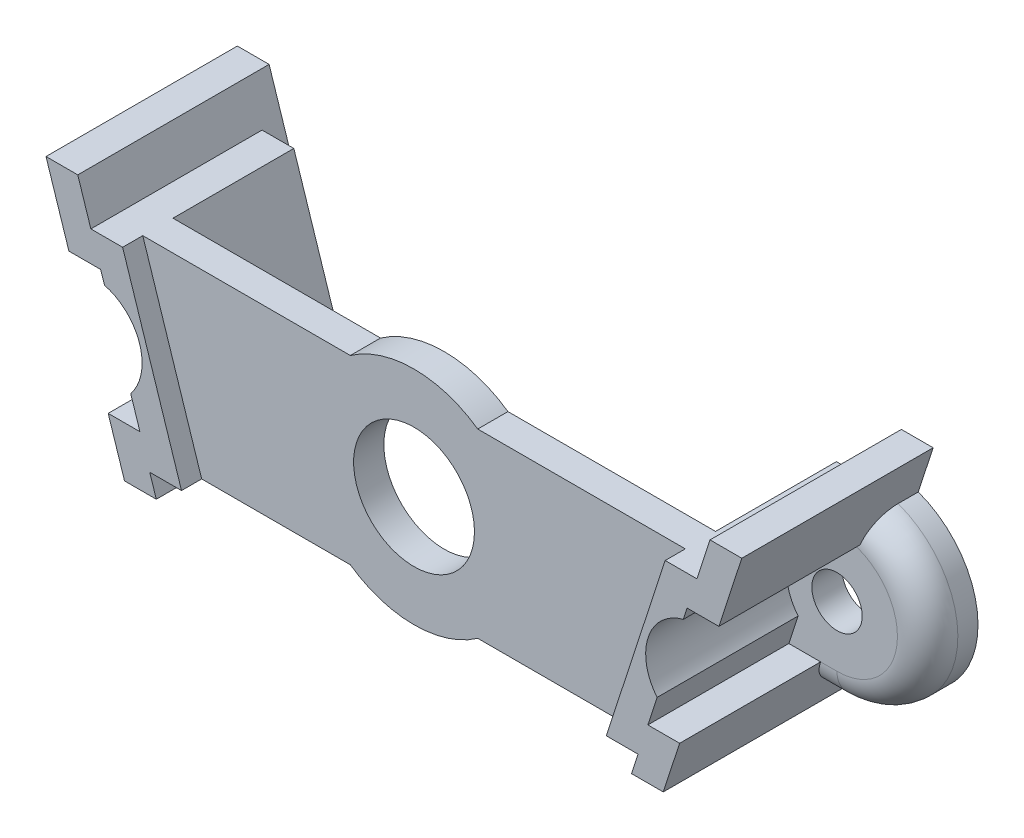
SolidWorks part; units mm, degrees
ref_plane "Face" through (0, 0, 0) normal (0, 0, 1) x (1, 0, 0)
ref_plane "Dessus" through (0, 0, 0) normal (0, 1, 0) x (1, 0, 0)
ref_plane "Droite" through (0, 0, 0) normal (1, 0, 0) x (0, 0, -1)
sketch "Esquisse2" plane through (0, 0, 6) normal (0, 0, 1) x (1, 0, 0)
  line L0 (-5.544, -4.5) -> (-7.1211, -4.5) construction
  line L1 (1.8377, -4.5) -> (-7.1211, -4.5)
  line L2 (-8.4682, 4.5) -> (-10.0454, 4.5) construction
  line L3 (1.8377, 4.5) -> (-10.0454, 4.5)
  line L4 (17.1211, -4.5) -> (15.544, -4.5) construction
  line L5 (17.1211, -4.5) -> (8.1623, -4.5)
  line L6 (20.0454, 4.5) -> (18.4682, 4.5) construction
  line L7 (20.0454, 4.5) -> (8.1623, 4.5)
  line L8 (-8.0678, -1.5864) -> (-7.1211, -4.5) construction
  line L9 (-10.0454, 4.5) -> (-7.1211, -4.5)
  line L10 (17.1211, -4.5) -> (18.0678, -1.5864) construction
  line L11 (17.1211, -4.5) -> (20.0454, 4.5)
  arc A0 (1.8377, -4.5) -> (8.1623, -4.5) centre (5, 0) ccw
  circle A1 centre (5, 0) radius 3 construction
  circle A2 centre (5, 0) radius 3
  arc A3 (8.1623, 4.5) -> (1.8377, 4.5) centre (5, 0) ccw
  point P17 (5, 0)
  dimension "D1" = 11
extrude "Extrusion1" add sketch "Esquisse2" along normal blind 1.5
ref_plane "Plan4" through (0, 0, 8.5) normal (0, 0, 1) x (1, 0, 0)
sketch "Esquisse4" plane through (0, 0, 8.5) normal (0, 0, -1) x (-1, 0, 0)
  line L0 (-20.6953, 6.5) -> (-20.0454, 4.5)
  line L1 (-20.0454, 4.5) -> (-18.4682, 4.5)
  line L2 (-20.0454, 4.5) -> (-8.1623, 4.5) construction
  line L3 (-18.4682, 4.5) -> (-15.544, -4.5)
  line L4 (-8.1623, -4.5) -> (-17.1211, -4.5) construction
  line L5 (-15.544, -4.5) -> (-17.1211, -4.5)
  line L6 (-17.1211, -4.5) -> (-16.7962, -5.5)
  line L7 (-17.1211, -4.5) -> (-20.0454, 4.5) construction
  line L8 (-20.6953, 6.5) -> (-22.2725, 6.5)
  line L9 (-16.7962, -5.5) -> (-18.3734, -5.5)
  line L10 (-19.558, 3) -> (-21.1352, 3)
  line L11 (-21.1352, 3) -> (-22.2725, 6.5)
  line L12 (-19.558, 3) -> (-17.6085, -3)
  line L13 (-17.6085, -3) -> (-19.1857, -3)
  line L14 (-19.1857, -3) -> (-18.3734, -5.5)
  line L15 (-20.0454, 4.5) -> (-19.558, 3) construction
  line L16 (-17.6085, -3) -> (-17.1211, -4.5) construction
  dimension "D1" = 2
  dimension "D2" = 1
  dimension "D3" = 1.5
extrude "Extrusion2" add sketch "Esquisse4" along normal blind 8.5
sketch "Esquisse6" plane through (0, 0, 0) normal (0, 0, -1) x (-1, 0, 0)
  line L0 (-15.544, -4.5) -> (-20, -4.5)
  line L1 (-20, 4.5) -> (-18.4682, 4.5)
  line L2 (-18.4682, 4.5) -> (-15.544, -4.5)
  line L3 (-18.4682, 4.5) -> (-20.0454, 4.5) construction
  arc A0 (-20, -4.5) -> (-20, 4.5) centre (-20, 0) cw
  arc A1 (-19.3693, 2.4191) -> (-18.0678, -1.5864) centre (-20, 0) ccw construction
extrude "Extrusion3" add sketch "Esquisse6" against normal blind 1.5
sketch "Esquisse7" plane through (0, 0, 1.5) normal (0, 0, 1) x (1, 0, 0)
  circle A0 centre (20, 0) radius 1.25
  arc A1 (20, -4.5) -> (21.5349, 4.2301) centre (20, 0) ccw construction
  dimension "D1" = 2.5
extrude "Enlèv. mat.-Extru.1" cut sketch "Esquisse7" against normal through all
sketch "Esquisse8" plane through (0, 0, 0) normal (0, 0, -1) x (-1, 0, 0)
  line L0 (-20.6953, 6.5) -> (-19.5469, 2.9656)
  line L1 (-20.0454, 4.5) -> (-20.6953, 6.5) construction
  line L2 (-20.6953, 6.5) -> (-22.2725, 6.5) construction
  line L3 (-20.6953, 6.5) -> (-22.2725, 6.5)
  line L4 (-22.2725, 6.5) -> (-21.5349, 4.2301) construction
  line L5 (-22.2725, 6.5) -> (-21.5349, 4.2301)
  line L6 (-20, -4.5) -> (-18.6983, -4.5) construction
  line L7 (-20, -4.5) -> (-18.6983, -4.5)
  line L8 (-18.6983, -4.5) -> (-18.3734, -5.5) construction
  line L9 (-18.6983, -4.5) -> (-18.3734, -5.5)
  line L10 (-18.3734, -5.5) -> (-16.7962, -5.5) construction
  line L11 (-18.3734, -5.5) -> (-16.7962, -5.5)
  line L12 (-16.7962, -5.5) -> (-17.1211, -4.5) construction
  line L13 (-16.7962, -5.5) -> (-17.6085, -3)
  line L14 (-20, -3) -> (-17.6085, -3)
  arc A0 (-21.5349, 4.2301) -> (-20, -4.5) centre (-20, 0) ccw construction
  arc A1 (-21.5349, 4.2301) -> (-20, -4.5) centre (-20, 0) ccw
  arc A2 (-19.5469, 2.9656) -> (-20, -3) centre (-20, 0) ccw
  circle A3 centre (-20, 0) radius 1.25 construction
  dimension "D1" = 1.5
extrude "Extrusion4" add sketch "Esquisse8" along normal blind 1
fillet "Congé1" radius 1.5
sketch "Esquisse9" plane through (0, 0, 1.5) normal (0, 0, 1) x (1, 0, 0)
  circle A0 centre (20, 0) radius 2.5
  circle A1 centre (20, 0) radius 1.25 construction
  dimension "D1" = 5
extrude "Enlèv. mat.-Extru.2" cut sketch "Esquisse9" along normal through all
ref_plane "Plan5" through (5, 0, 0) normal (1, 0, 0) x (0, 0, -1)
mirror "Symétrie1" about plane through (5, 0, 0) normal (1, 0, 0)
